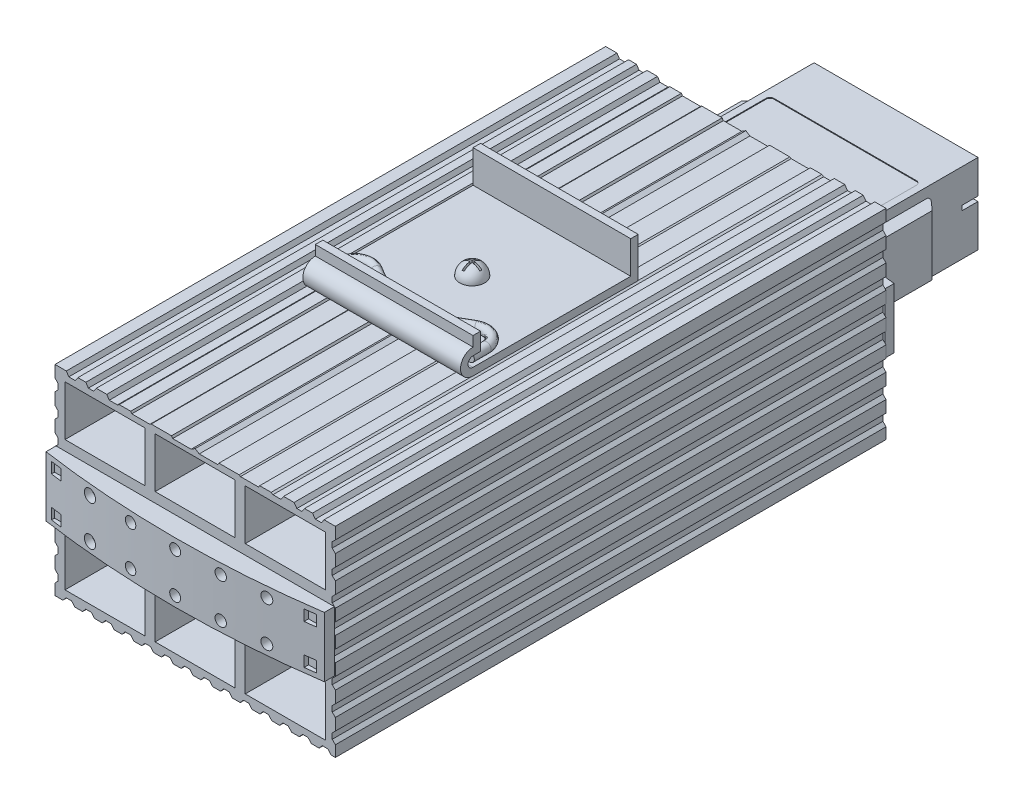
SolidWorks part; units mm, degrees
other "LUMP1"
other "Камера2"
other "Камера3"
ref_plane "Спереди" through (0, 0, 0) normal (0, 0, 1) x (1, 0, 0)
ref_plane "Сверху" through (0, 0, 0) normal (0, 1, 0) x (1, 0, 0)
ref_plane "Справа" through (0, 0, 0) normal (1, 0, 0) x (0, 0, -1)
imported_body "Импортированный1"
sketch "Эскиз1" plane through (0, 0, 139.7) normal (0, 0, 1) x (1, 0, 0)
  line L0 (-35.56, 22.4) -> (-34.76, 21.6)
  line L1 (-35.56, 25.4) -> (-35.56, -25.4) construction
  line L2 (-34.76, 21.6) -> (-34.76, 20.2)
  line L3 (-34.76, 20.2) -> (-35.56, 19.4)
  line L4 (-35.56, 19.4) -> (-36.4722, 19.4)
  line L5 (-36.4722, 19.4) -> (-36.4722, 22.4)
  line L6 (-36.4722, 22.4) -> (-35.56, 22.4)
  line L7 (35.56, 25.4) -> (-35.56, 25.4) construction
  line L8 (0, 25.4) -> (0, 18.4457) construction
  line L9 (-35.56, 16.4) -> (-34.76, 15.6)
  line L10 (-34.76, 15.6) -> (-34.76, 14.2)
  line L11 (-34.76, 14.2) -> (-35.56, 13.4)
  line L12 (-35.56, 13.4) -> (-36.4722, 13.4)
  line L13 (-36.4722, 13.4) -> (-36.4722, 16.4)
  line L14 (-36.4722, 16.4) -> (-35.56, 16.4)
  line L15 (-35.56, 10.4) -> (-34.76, 9.6)
  line L16 (-34.76, 9.6) -> (-34.76, 8.2)
  line L17 (-34.76, 8.2) -> (-35.56, 7.4)
  line L18 (-35.56, 7.4) -> (-36.4722, 7.4)
  line L19 (-36.4722, 7.4) -> (-36.4722, 10.4)
  line L20 (-36.4722, 10.4) -> (-35.56, 10.4)
  line L21 (-35.56, 4.4) -> (-34.76, 3.6)
  line L22 (-34.76, 3.6) -> (-34.76, 2.2)
  line L23 (-34.76, 2.2) -> (-35.56, 1.4)
  line L24 (-35.56, 1.4) -> (-36.4722, 1.4)
  line L25 (-36.4722, 1.4) -> (-36.4722, 4.4)
  line L26 (-36.4722, 4.4) -> (-35.56, 4.4)
  line L27 (-35.56, -1.6) -> (-34.76, -2.4)
  line L28 (-34.76, -2.4) -> (-34.76, -3.8)
  line L29 (-34.76, -3.8) -> (-35.56, -4.6)
  line L30 (-35.56, -4.6) -> (-36.4722, -4.6)
  line L31 (-36.4722, -4.6) -> (-36.4722, -1.6)
  line L32 (-36.4722, -1.6) -> (-35.56, -1.6)
  line L33 (-35.56, -7.6) -> (-34.76, -8.4)
  line L34 (-34.76, -8.4) -> (-34.76, -9.8)
  line L35 (-34.76, -9.8) -> (-35.56, -10.6)
  line L36 (-35.56, -10.6) -> (-36.4722, -10.6)
  line L37 (-36.4722, -10.6) -> (-36.4722, -7.6)
  line L38 (-36.4722, -7.6) -> (-35.56, -7.6)
  line L39 (-35.56, -13.6) -> (-34.76, -14.4)
  line L40 (-34.76, -14.4) -> (-34.76, -15.8)
  line L41 (-34.76, -15.8) -> (-35.56, -16.6)
  line L42 (-35.56, -16.6) -> (-36.4722, -16.6)
  line L43 (-36.4722, -16.6) -> (-36.4722, -13.6)
  line L44 (-36.4722, -13.6) -> (-35.56, -13.6)
  line L45 (-35.56, -19.6) -> (-34.76, -20.4)
  line L46 (-34.76, -20.4) -> (-34.76, -21.8)
  line L47 (-34.76, -21.8) -> (-35.56, -22.6)
  line L48 (-35.56, -22.6) -> (-36.4722, -22.6)
  line L49 (-36.4722, -22.6) -> (-36.4722, -19.6)
  line L50 (-36.4722, -19.6) -> (-35.56, -19.6)
  line L51 (36.4722, -19.6) -> (35.56, -19.6)
  line L52 (36.4722, -22.6) -> (36.4722, -19.6)
  line L53 (35.56, -22.6) -> (36.4722, -22.6)
  line L54 (34.76, -21.8) -> (35.56, -22.6)
  line L55 (34.76, -20.4) -> (34.76, -21.8)
  line L56 (35.56, -19.6) -> (34.76, -20.4)
  line L57 (36.4722, -13.6) -> (35.56, -13.6)
  line L58 (36.4722, -16.6) -> (36.4722, -13.6)
  line L59 (35.56, -16.6) -> (36.4722, -16.6)
  line L60 (34.76, -15.8) -> (35.56, -16.6)
  line L61 (34.76, -14.4) -> (34.76, -15.8)
  line L62 (35.56, -13.6) -> (34.76, -14.4)
  line L63 (36.4722, -7.6) -> (35.56, -7.6)
  line L64 (36.4722, -10.6) -> (36.4722, -7.6)
  line L65 (35.56, -10.6) -> (36.4722, -10.6)
  line L66 (34.76, -9.8) -> (35.56, -10.6)
  line L67 (34.76, -8.4) -> (34.76, -9.8)
  line L68 (35.56, -7.6) -> (34.76, -8.4)
  line L69 (36.4722, -1.6) -> (35.56, -1.6)
  line L70 (36.4722, -4.6) -> (36.4722, -1.6)
  line L71 (35.56, -4.6) -> (36.4722, -4.6)
  line L72 (34.76, -3.8) -> (35.56, -4.6)
  line L73 (34.76, -2.4) -> (34.76, -3.8)
  line L74 (35.56, -1.6) -> (34.76, -2.4)
  line L75 (36.4722, 4.4) -> (35.56, 4.4)
  line L76 (36.4722, 1.4) -> (36.4722, 4.4)
  line L77 (35.56, 1.4) -> (36.4722, 1.4)
  line L78 (34.76, 2.2) -> (35.56, 1.4)
  line L79 (34.76, 3.6) -> (34.76, 2.2)
  line L80 (35.56, 4.4) -> (34.76, 3.6)
  line L81 (36.4722, 10.4) -> (35.56, 10.4)
  line L82 (36.4722, 7.4) -> (36.4722, 10.4)
  line L83 (35.56, 7.4) -> (36.4722, 7.4)
  line L84 (34.76, 8.2) -> (35.56, 7.4)
  line L85 (34.76, 9.6) -> (34.76, 8.2)
  line L86 (35.56, 10.4) -> (34.76, 9.6)
  line L87 (36.4722, 16.4) -> (35.56, 16.4)
  line L88 (36.4722, 13.4) -> (36.4722, 16.4)
  line L89 (35.56, 13.4) -> (36.4722, 13.4)
  line L90 (34.76, 14.2) -> (35.56, 13.4)
  line L91 (34.76, 15.6) -> (34.76, 14.2)
  line L92 (35.56, 16.4) -> (34.76, 15.6)
  line L93 (36.4722, 22.4) -> (35.56, 22.4)
  line L94 (36.4722, 19.4) -> (36.4722, 22.4)
  line L95 (35.56, 19.4) -> (36.4722, 19.4)
  line L96 (34.76, 20.2) -> (35.56, 19.4)
  line L97 (34.76, 21.6) -> (34.76, 20.2)
  line L98 (35.56, 22.4) -> (34.76, 21.6)
  dimension "D1" = 3
  dimension "D2" = 1.4
  dimension "D3" = 0.8
  dimension "D4" = 3
  dimension "D5" = 8
extrude "Вырез-Вытянуть1" cut sketch "Эскиз1" against normal up to surface (139.7 mm away)
sketch "Эскиз2" plane through (0, 0, 139.7) normal (0, 0, 1) x (1, 0, 0)
  line L0 (-33.56, -25.4) -> (-32.76, -24.458)
  line L1 (-35.56, -25.4) -> (35.56, -25.4) construction
  line L2 (-32.76, -24.458) -> (-31.36, -24.458)
  line L3 (-31.36, -24.458) -> (-30.56, -25.4)
  line L4 (-30.56, -25.4) -> (-30.56, -26.268)
  line L5 (-30.56, -26.268) -> (-33.56, -26.268)
  line L6 (-33.56, -26.268) -> (-33.56, -25.4)
  line L7 (-35.56, -22.6) -> (-35.56, -25.4) construction
  line L8 (-28.56, -25.4) -> (-27.76, -24.458)
  line L9 (-27.76, -24.458) -> (-26.36, -24.458)
  line L10 (-26.36, -24.458) -> (-25.56, -25.4)
  line L11 (-25.56, -25.4) -> (-25.56, -26.268)
  line L12 (-25.56, -26.268) -> (-28.56, -26.268)
  line L13 (-28.56, -26.268) -> (-28.56, -25.4)
  line L14 (-23.56, -25.4) -> (-22.76, -24.458)
  line L15 (-22.76, -24.458) -> (-21.36, -24.458)
  line L16 (-21.36, -24.458) -> (-20.56, -25.4)
  line L17 (-20.56, -25.4) -> (-20.56, -26.268)
  line L18 (-20.56, -26.268) -> (-23.56, -26.268)
  line L19 (-23.56, -26.268) -> (-23.56, -25.4)
  line L20 (-18.56, -25.4) -> (-17.76, -24.458)
  line L21 (-17.76, -24.458) -> (-16.36, -24.458)
  line L22 (-16.36, -24.458) -> (-15.56, -25.4)
  line L23 (-15.56, -25.4) -> (-15.56, -26.268)
  line L24 (-15.56, -26.268) -> (-18.56, -26.268)
  line L25 (-18.56, -26.268) -> (-18.56, -25.4)
  line L26 (-13.56, -25.4) -> (-12.76, -24.458)
  line L27 (-12.76, -24.458) -> (-11.36, -24.458)
  line L28 (-11.36, -24.458) -> (-10.56, -25.4)
  line L29 (-10.56, -25.4) -> (-10.56, -26.268)
  line L30 (-10.56, -26.268) -> (-13.56, -26.268)
  line L31 (-13.56, -26.268) -> (-13.56, -25.4)
  line L32 (-8.56, -25.4) -> (-7.76, -24.458)
  line L33 (-7.76, -24.458) -> (-6.36, -24.458)
  line L34 (-6.36, -24.458) -> (-5.56, -25.4)
  line L35 (-5.56, -25.4) -> (-5.56, -26.268)
  line L36 (-5.56, -26.268) -> (-8.56, -26.268)
  line L37 (-8.56, -26.268) -> (-8.56, -25.4)
  line L38 (-3.56, -25.4) -> (-2.76, -24.458)
  line L39 (-2.76, -24.458) -> (-1.36, -24.458)
  line L40 (-1.36, -24.458) -> (-0.56, -25.4)
  line L41 (-0.56, -25.4) -> (-0.56, -26.268)
  line L42 (-0.56, -26.268) -> (-3.56, -26.268)
  line L43 (-3.56, -26.268) -> (-3.56, -25.4)
  line L44 (1.44, -25.4) -> (2.24, -24.458)
  line L45 (2.24, -24.458) -> (3.64, -24.458)
  line L46 (3.64, -24.458) -> (4.44, -25.4)
  line L47 (4.44, -25.4) -> (4.44, -26.268)
  line L48 (4.44, -26.268) -> (1.44, -26.268)
  line L49 (1.44, -26.268) -> (1.44, -25.4)
  line L50 (6.44, -25.4) -> (7.24, -24.458)
  line L51 (7.24, -24.458) -> (8.64, -24.458)
  line L52 (8.64, -24.458) -> (9.44, -25.4)
  line L53 (9.44, -25.4) -> (9.44, -26.268)
  line L54 (9.44, -26.268) -> (6.44, -26.268)
  line L55 (6.44, -26.268) -> (6.44, -25.4)
  line L56 (11.44, -25.4) -> (12.24, -24.458)
  line L57 (12.24, -24.458) -> (13.64, -24.458)
  line L58 (13.64, -24.458) -> (14.44, -25.4)
  line L59 (14.44, -25.4) -> (14.44, -26.268)
  line L60 (14.44, -26.268) -> (11.44, -26.268)
  line L61 (11.44, -26.268) -> (11.44, -25.4)
  line L62 (16.44, -25.4) -> (17.24, -24.458)
  line L63 (17.24, -24.458) -> (18.64, -24.458)
  line L64 (18.64, -24.458) -> (19.44, -25.4)
  line L65 (19.44, -25.4) -> (19.44, -26.268)
  line L66 (19.44, -26.268) -> (16.44, -26.268)
  line L67 (16.44, -26.268) -> (16.44, -25.4)
  line L68 (21.44, -25.4) -> (22.24, -24.458)
  line L69 (22.24, -24.458) -> (23.64, -24.458)
  line L70 (23.64, -24.458) -> (24.44, -25.4)
  line L71 (24.44, -25.4) -> (24.44, -26.268)
  line L72 (24.44, -26.268) -> (21.44, -26.268)
  line L73 (21.44, -26.268) -> (21.44, -25.4)
  line L74 (26.44, -25.4) -> (27.24, -24.458)
  line L75 (27.24, -24.458) -> (28.64, -24.458)
  line L76 (28.64, -24.458) -> (29.44, -25.4)
  line L77 (29.44, -25.4) -> (29.44, -26.268)
  line L78 (29.44, -26.268) -> (26.44, -26.268)
  line L79 (26.44, -26.268) -> (26.44, -25.4)
  line L80 (31.44, -25.4) -> (32.24, -24.458)
  line L81 (32.24, -24.458) -> (33.64, -24.458)
  line L82 (33.64, -24.458) -> (34.44, -25.4)
  line L83 (34.44, -25.4) -> (34.44, -26.268)
  line L84 (34.44, -26.268) -> (31.44, -26.268)
  line L85 (31.44, -26.268) -> (31.44, -25.4)
  dimension "D1" = 3
  dimension "D2" = 1.4
  dimension "D3" = 0.8
  dimension "D4" = 2
  dimension "D5" = 14
extrude "Вырез-Вытянуть2" cut sketch "Эскиз2" against normal up to surface (139.7 mm away)
sketch "Эскиз3" plane through (0, 0, 139.7) normal (0, 0, 1) x (1, 0, 0)
  line L0 (0, 26.3484) -> (0, 18.8696) construction
  line L1 (-32.6919, 25.4) -> (-32.0578, 24.4207)
  line L2 (35.56, 25.4) -> (-35.56, 25.4) construction
  line L3 (-32.0578, 24.4207) -> (-30.4726, 24.4207)
  line L4 (-30.4726, 24.4207) -> (-29.7592, 25.4)
  line L5 (-29.7592, 25.4) -> (-27.738, 25.4)
  line L6 (-27.738, 25.4) -> (-27.1038, 24.4207)
  line L7 (-27.1038, 24.4207) -> (-25.796, 24.4207)
  line L8 (-25.796, 24.4207) -> (-25.0826, 25.4)
  line L9 (-25.0826, 25.4) -> (-22.4273, 25.4)
  line L10 (-22.4273, 25.4) -> (-21.7932, 24.4207)
  line L11 (-21.7932, 24.4207) -> (-19.7323, 24.4207)
  line L12 (-19.7323, 24.4207) -> (-19.2723, 24.7186)
  line L13 (-19.2723, 24.7186) -> (-16.3636, 24.7186)
  line L14 (-16.3636, 24.7186) -> (-16.0808, 24.2819)
  line L15 (-16.0808, 24.2819) -> (-11.4889, 24.2819)
  line L16 (-11.4889, 24.2819) -> (-11.1517, 24.5003)
  line L17 (-11.1517, 24.5003) -> (-6.0197, 24.5003)
  line L18 (-6.0197, 24.5003) -> (-5.7163, 24.0318)
  line L19 (-5.7163, 24.0318) -> (-1.0261, 24.0318)
  line L20 (-1.0261, 24.0318) -> (-0.6643, 24.266)
  line L21 (-0.6643, 24.266) -> (0, 24.6962)
  line L22 (-32.6919, 25.4) -> (-32.6919, 26.3484)
  line L23 (-32.6919, 26.3484) -> (-20.0025, 26.3484)
  line L24 (-20.0025, 31.75) -> (-20.0025, 25.4) construction
  line L25 (-20.0025, 26.3484) -> (-20.0025, 25.4)
  line L26 (20.0025, 26.3484) -> (20.0025, 25.4)
  line L27 (32.6919, 26.3484) -> (20.0025, 26.3484)
  line L28 (32.6919, 25.4) -> (32.6919, 26.3484)
  line L29 (0.6643, 24.266) -> (0, 24.6962)
  line L30 (1.0261, 24.0318) -> (0.6643, 24.266)
  line L31 (5.7163, 24.0318) -> (1.0261, 24.0318)
  line L32 (6.0197, 24.5003) -> (5.7163, 24.0318)
  line L33 (11.1517, 24.5003) -> (6.0197, 24.5003)
  line L34 (11.4889, 24.2819) -> (11.1517, 24.5003)
  line L35 (16.0808, 24.2819) -> (11.4889, 24.2819)
  line L36 (16.3636, 24.7186) -> (16.0808, 24.2819)
  line L37 (19.2723, 24.7186) -> (16.3636, 24.7186)
  line L38 (19.7323, 24.4207) -> (19.2723, 24.7186)
  line L39 (21.7932, 24.4207) -> (19.7323, 24.4207)
  line L40 (22.4273, 25.4) -> (21.7932, 24.4207)
  line L41 (25.0826, 25.4) -> (22.4273, 25.4)
  line L42 (25.796, 24.4207) -> (25.0826, 25.4)
  line L43 (27.1038, 24.4207) -> (25.796, 24.4207)
  line L44 (27.738, 25.4) -> (27.1038, 24.4207)
  line L45 (29.7592, 25.4) -> (27.738, 25.4)
  line L46 (30.4726, 24.4207) -> (29.7592, 25.4)
  line L47 (32.0578, 24.4207) -> (30.4726, 24.4207)
  line L48 (32.6919, 25.4) -> (32.0578, 24.4207)
  line L49 (-20.0025, 25.4) -> (20.0025, 25.4)
extrude "Вырез-Вытянуть3" cut sketch "Эскиз3" against normal up to surface (139.7 mm away)
ref_plane "Плоскость1" through (0, 0, 145.7) normal (0, 0, 1) x (1, 0, 0)
sketch "Эскиз4" plane through (0, 0, 145.7) normal (0, 0, 1) x (1, 0, 0)
  line L0 (0, 0) -> (5.2597, 0) construction
  line L1 (-33.6904, 6.4372) -> (-30.9184, 6.4372)
  line L2 (-33.6904, 6.4372) -> (-33.6904, 3.6652)
  line L3 (-33.6904, 3.6652) -> (-30.9184, 3.6652)
  line L4 (-30.9184, 6.4372) -> (-30.9184, 3.6652)
  line L5 (33.5482, 6.4372) -> (30.7762, 6.4372)
  line L6 (33.5482, 6.4372) -> (33.5482, 3.6652)
  line L7 (33.5482, 3.6652) -> (30.7762, 3.6652)
  line L8 (30.7762, 6.4372) -> (30.7762, 3.6652)
  line L9 (30.7762, -6.4372) -> (30.7762, -3.6652)
  line L10 (33.5482, -3.6652) -> (30.7762, -3.6652)
  line L11 (33.5482, -6.4372) -> (33.5482, -3.6652)
  line L12 (33.5482, -6.4372) -> (30.7762, -6.4372)
  line L13 (-30.9184, -6.4372) -> (-30.9184, -3.6652)
  line L14 (-33.6904, -3.6652) -> (-30.9184, -3.6652)
  line L15 (-33.6904, -6.4372) -> (-33.6904, -3.6652)
  line L16 (-33.6904, -6.4372) -> (-30.9184, -6.4372)
  circle A0 centre (-22.6735, 5.0512) radius 1.5576
  circle A1 centre (-11.5855, 5.0512) radius 1.386
  circle A2 centre (0, 5.0512) radius 1.386
  circle A3 centre (11.3012, 5.0512) radius 1.386
  circle A4 centre (22.247, 5.0512) radius 1.386
  circle A5 centre (22.247, -5.0512) radius 1.386
  circle A6 centre (11.3012, -5.0512) radius 1.386
  circle A7 centre (0, -5.0512) radius 1.386
  circle A8 centre (-11.5855, -5.0512) radius 1.386
  circle A9 centre (-22.6735, -5.0512) radius 1.5576
extrude "Вырез-Вытянуть4" cut sketch "Эскиз4" against normal blind 4
sketch "Эскиз5" plane through (0, -11.684, 0) normal (0, -1, 0) x (1, 0, 0)
  circle A0 centre (-12.5908, -33.02) radius 2.0132
extrude "Вырез-Вытянуть5" cut sketch "Эскиз5" against normal blind 0.5
sketch "Эскиз6" plane through (0, -11.184, 0) normal (0, -1, 0) x (1, 0, 0)
  line L0 (-12.5908, -31.0068) -> (-12.5908, -35.0332) construction
  line L2 (-13.5908, -33.789) -> (-11.5908, -33.789)
  line L3 (-13.5908, -33.789) -> (-13.5908, -34.029)
  line L4 (-13.5908, -34.029) -> (-11.5908, -34.029)
  line L5 (-11.5908, -33.789) -> (-11.5908, -34.029)
  line L6 (-13.8908, -33.249) -> (-11.2908, -33.249)
  line L7 (-13.8908, -33.249) -> (-13.8908, -33.489)
  line L8 (-13.8908, -33.489) -> (-11.2908, -33.489)
  line L9 (-11.2908, -33.249) -> (-11.2908, -33.489)
  line L10 (-14.0382, -32.709) -> (-12.7108, -32.709)
  line L11 (-14.0382, -32.709) -> (-14.0382, -32.949)
  line L12 (-14.0382, -32.949) -> (-11.1248, -32.949)
  line L13 (-11.1248, -32.709) -> (-11.1248, -32.949)
  line L14 (-12.7108, -31.2596) -> (-12.4708, -31.2596)
  line L15 (-12.7108, -31.2596) -> (-12.7108, -32.709)
  line L17 (-12.4708, -31.2596) -> (-12.4708, -32.709)
  line L18 (-12.4708, -32.709) -> (-11.1248, -32.709)
  circle A0 centre (-12.5908, -33.02) radius 2.0132 construction
  circle A1 centre (-12.5908, -33.02) radius 2.0132 construction
  dimension "D1" = 0.24
  dimension "D2" = 1
  dimension "D3" = 2
  dimension "D4" = 0.24
  dimension "D5" = 1.3
  dimension "D6" = 2.6
  dimension "D7" = 0.24
  dimension "D8" = 0.12
  dimension "D9" = 0.24
  dimension "D10" = 0.3
  dimension "D11" = 0.3
extrude "Бобышка-Вытянуть1" add sketch "Эскиз6" along normal blind 0.6
sketch "Эскиз7" plane through (0, -11.684, 0) normal (0, -1, 0) x (1, 0, 0)
  circle A0 centre (-0.0025, -33.02) radius 2.0398
extrude "Вырез-Вытянуть6" cut sketch "Эскиз7" against normal blind 0.5
sketch "Эскиз8" plane through (0, -11.184, 0) normal (0, -1, 0) x (1, 0, 0)
  line L0 (-0.542, -31.3303) -> (-0.542, -34.008)
  line L1 (-0.542, -34.008) -> (1.2756, -34.008)
  line L2 (1.2756, -34.008) -> (1.2756, -34.248)
  line L3 (1.2756, -34.248) -> (-0.782, -34.248)
  line L4 (-0.782, -34.248) -> (-0.782, -31.3303)
  line L5 (-0.782, -31.3303) -> (-0.542, -31.3303)
  dimension "D1" = 0.24
  dimension "D2" = 0.24
extrude "Бобышка-Вытянуть2" add sketch "Эскиз8" along normal blind 0.6
sketch "Эскиз9" plane through (0, -11.684, 0) normal (0, -1, 0) x (1, 0, 0)
  circle A0 centre (12.5857, -33.02) radius 2.0229
extrude "Вырез-Вытянуть7" cut sketch "Эскиз9" against normal blind 0.6
sketch "Эскиз10" plane through (0, -11.084, 0) normal (0, -1, 0) x (1, 0, 0)
  line L0 (13.7431, -31.5917) -> (13.7431, -34.3518)
  line L1 (13.7431, -34.3518) -> (13.479, -34.3518)
  line L2 (13.479, -34.3518) -> (11.6964, -31.9271)
  line L3 (11.6964, -31.9271) -> (11.6964, -34.3518)
  line L4 (11.6964, -34.3518) -> (11.4564, -34.3518)
  line L5 (11.4564, -34.3518) -> (11.4564, -31.5547)
  line L6 (11.4564, -31.5547) -> (11.7206, -31.5547)
  line L7 (11.7206, -31.5547) -> (13.5031, -33.9794)
  line L8 (13.5031, -33.9794) -> (13.5031, -31.5917)
  line L9 (13.5031, -31.5917) -> (13.7431, -31.5917)
  dimension "D1" = 0.24
  dimension "D2" = 0.24
  dimension "D3" = 0.24
extrude "Бобышка-Вытянуть3" add sketch "Эскиз10" along normal blind 0.6
sketch "Эскиз11" plane through (0, 0, -38.1) normal (0, 0, -1) x (-1, 0, 0)
  line L0 (20.7892, -7.62) -> (20.7892, 7.62) construction
  line L1 (20.7892, 0.4731) -> (-20.7892, 0.4731)
  line L2 (20.7892, 0.4731) -> (20.7892, 1.6661)
  line L3 (20.7892, 1.6661) -> (-20.7892, 1.6661)
  line L4 (-20.7892, 0.4731) -> (-20.7892, 1.6661)
  line L5 (-20.7892, -10.16) -> (-20.7892, 10.16) construction
extrude "Вырез-Вытянуть8" cut sketch "Эскиз11" against normal blind 4
sketch "Эскиз12" plane through (0, -10.16, 0) normal (0, -1, 0) x (1, 0, 0)
  line L0 (-18.2499, -30.48) -> (-18.2499, -35.56) construction
  line L1 (-19.1499, -8.1129) -> (-18.5499, -8.1129)
  line L2 (-19.1499, -8.1129) -> (-19.1499, -36.2162)
  line L4 (-18.5499, -8.1129) -> (-18.5499, -35.7896)
  line L5 (-6.5617, -8.1129) -> (-5.9617, -8.1129)
  line L6 (-6.5617, -8.1129) -> (-6.5617, -35.7896)
  line L8 (-5.9617, -8.1129) -> (-5.9617, -35.7896)
  line L9 (6.6266, -8.1129) -> (6.0266, -8.1129)
  line L10 (6.6266, -8.1129) -> (6.6266, -35.7855)
  line L12 (6.0266, -8.1129) -> (6.0266, -35.7896)
  line L15 (18.5448, -8.1129) -> (19.1448, -8.1129)
  line L16 (19.1448, -36.2162) -> (19.1448, -8.1129)
  line L17 (-5.6617, -30.48) -> (-5.6617, -35.56) construction
  line L18 (6.9266, -35.56) -> (6.9266, -30.48) construction
  line L21 (-19.1499, -36.2162) -> (19.1448, -36.2162)
  line L26 (-5.9617, -35.7896) -> (6.0266, -35.7896)
  line L29 (-18.5499, -35.7896) -> (-6.5617, -35.7896)
  line L30 (6.6266, -35.7855) -> (18.5448, -35.7855)
  line L34 (18.5448, -35.7855) -> (18.5448, -8.1129)
  dimension "D1" = 0.6
  dimension "D2" = 0.3
  dimension "D3" = 0.6
  dimension "D4" = 0.3
  dimension "D5" = 0.6
  dimension "D6" = 0.3
extrude "Вырез-Вытянуть9" cut sketch "Эскиз12" against normal blind 1
ref_plane "Плоскость2" through (0, 0, -6) normal (0, 0, -1) x (-1, 0, 0)
sketch "Эскиз13" plane through (0, 0, -6) normal (0, 0, -1) x (-1, 0, 0)
  line L1 (-33.9569, 6.3727) -> (-31.232, 6.3727)
  line L2 (-33.9569, 6.3727) -> (-33.9569, 3.508)
  line L3 (-33.9569, 3.508) -> (-31.232, 3.508)
  line L4 (-31.232, 6.3727) -> (-31.232, 3.508)
  line L5 (30.7429, 6.3727) -> (33.5377, 6.3727)
  line L6 (30.7429, 6.3727) -> (30.7429, 3.508)
  line L7 (30.7429, 3.508) -> (33.5377, 3.508)
  line L8 (33.5377, 6.3727) -> (33.5377, 3.508)
  line L9 (33.5377, -6.0642) -> (30.7429, -6.0642)
  line L10 (33.5377, -6.0642) -> (33.5377, -2.8502)
  line L11 (33.5377, -2.8502) -> (30.7429, -2.8502)
  line L12 (30.7429, -6.0642) -> (30.7429, -2.8502)
  line L13 (-31.232, -6.0642) -> (-33.9569, -6.0642)
  line L14 (-31.232, -6.0642) -> (-31.232, -2.8502)
  line L15 (-31.232, -2.8502) -> (-33.9569, -2.8502)
  line L16 (-33.9569, -6.0642) -> (-33.9569, -2.8502)
extrude "Вырез-Вытянуть10" cut sketch "Эскиз13" against normal blind 4
ref_plane "Плоскость3" through (0, 28.555, 0) normal (0, 1, 0) x (1, 0, 0)
sketch "Эскиз14" plane through (0, 28.555, 0) normal (0, 1, 0) x (1, 0, 0)
  line L0 (-18.4875, -90.3108) -> (-18.4875, -84.0764)
  line L1 (-12.1845, -81.5701) -> (-1.1719, -87.9283)
  line L2 (-20.0025, -87.3125) -> (20.0025, -87.3125) construction
  arc A0 (-18.4875, -84.0764) -> (-12.1845, -81.5701) centre (-14.6245, -84.6125) cw
  dimension "D2" = 3.9
  dimension "D1" = 2.7
  dimension "D3" = 60
ref_plane "Плоскость4" through (0, 0, 88.5625) normal (0, 0, -1) x (-1, 0, 0)
sketch "Эскиз15" plane through (0, 0, 88.5625) normal (0, 0, -1) x (-1, 0, 0)
  line L0 (18.4875, 28.555) -> (12.1845, 28.555) construction
  circle A0 centre (18.4875, 28.555) radius 1.1514
sweep "По траектории1" add profiles "Эскиз15" path "Эскиз14"
sketch "Эскиз16" plane through (0, 28.555, 0) normal (0, 1, 0) x (1, 0, 0)
  line L0 (18.6094, -89.5898) -> (18.6094, -84.3099)
  line L1 (12.7646, -81.135) -> (1.3619, -87.7184)
  line L2 (-20.0025, -87.3125) -> (20.0025, -87.3125) construction
  arc A0 (18.6094, -84.3099) -> (12.7646, -81.135) centre (14.7146, -84.5125) ccw
  dimension "D2" = 3.9
  dimension "D1" = 2.8
  dimension "D3" = 60
sketch "Эскиз17" plane through (0, 0, 88.5625) normal (0, 0, -1) x (-1, 0, 0)
  line L0 (-12.7646, 28.555) -> (-18.6094, 28.555) construction
  circle A0 centre (-18.4828, 28.555) radius 1.1931
sweep "По траектории2" add profiles "Эскиз17" path "Эскиз16"
sketch "Эскиз18" plane through (0, 27.305, 0) normal (0, 1, 0) x (1, 0, 0)
  line L0 (-20.0025, -69.215) -> (20.0025, -69.215) construction
  line L1 (-20.0025, -89.2175) -> (-20.0025, -49.2125) construction
  line L2 (20.0025, -89.2175) -> (20.0025, -49.2125) construction
  line L3 (-3.3605, -69.215) -> (2.9512, -69.215)
  arc A0 (-3.3605, -69.215) -> (2.9512, -69.215) centre (-0.2047, -69.215) cw
revolve "Повернуть1" add sketch "Эскиз18" angle 180 about L0
ref_plane "Плоскость5" through (0, 32.305, 0) normal (0, 1, 0) x (1, 0, 0)
sketch "Эскиз19" plane through (0, 32.305, 0) normal (0, 1, 0) x (1, 0, 0)
  line L0 (-0.25, -66.0595) -> (-0.25, -72.3705) construction
  line L1 (-3.3605, -69.215) -> (2.9512, -69.215) construction
  line L2 (-0.5, -66.965) -> (0, -66.965)
  line L3 (0, -66.965) -> (0, -68.965)
  line L4 (0, -68.965) -> (2, -68.965)
  line L5 (2, -68.965) -> (2, -69.465)
  line L6 (2, -69.465) -> (0, -69.465)
  line L7 (0, -69.465) -> (0, -71.465)
  line L8 (0, -71.465) -> (-0.5, -71.465)
  line L9 (-0.5, -71.465) -> (-0.5, -69.465)
  line L10 (-0.5, -69.465) -> (-2.5, -69.465)
  line L11 (-2.5, -69.465) -> (-2.5, -68.965)
  line L12 (-2.5, -68.965) -> (-0.5, -68.965)
  line L13 (-0.5, -68.965) -> (-0.5, -66.965)
  circle A0 centre (-0.2047, -69.215) radius 3.1558 construction
  dimension "D1" = 0.25
  dimension "D2" = 0.25
  dimension "D3" = 0.25
  dimension "D4" = 0.25
  dimension "D5" = 0.25
  dimension "D6" = 0.25
  dimension "D7" = 0.25
  dimension "D8" = 2
  dimension "D9" = 2
  dimension "D10" = 2
  dimension "D11" = 2
extrude "Вырез-Вытянуть11" cut sketch "Эскиз19" against normal blind 4
sketch "Эскиз20" plane through (0, 10.16, 0) normal (0, 1, 0) x (1, 0, 0)
  line L1 (18.0906, 7.5595) -> (-18.0766, 7.5595)
  line L2 (19.0906, 8.5595) -> (19.0906, 24.1872)
  line L3 (18.0906, 25.1872) -> (-18.0766, 25.1872)
  line L4 (-19.0766, 8.5595) -> (-19.0766, 24.1872)
  line L5 (19.0906, 7.5595) -> (-19.0766, 25.1872) construction
  line L6 (19.0906, 25.1872) -> (-19.0766, 7.5595) construction
  arc A0 (19.0906, 24.1872) -> (18.0906, 25.1872) centre (18.0906, 24.1872) ccw
  arc A1 (-18.0766, 7.5595) -> (-19.0766, 8.5595) centre (-18.0766, 8.5595) cw
  arc A2 (-18.0766, 25.1872) -> (-19.0766, 24.1872) centre (-18.0766, 24.1872) ccw
  arc A3 (18.0906, 7.5595) -> (19.0906, 8.5595) centre (18.0906, 8.5595) ccw
  point P4 (0.007, 16.3733)
  dimension "D1" = 1
sketch "Эскиз21" plane through (0, 10.16, 0) normal (0, 1, 0) x (1, 0, 0)
  line L0 (18.0906, 7.5595) -> (-18.0766, 7.5595)
  line L1 (19.0906, 8.5595) -> (19.0906, 24.1872)
  line L2 (18.0906, 25.1872) -> (-18.0766, 25.1872)
  line L3 (-19.0766, 8.5595) -> (-19.0766, 24.1872)
  line L4 (19.0906, 7.5595) -> (-19.0766, 25.1872) construction
  line L5 (19.0906, 25.1872) -> (-19.0766, 7.5595) construction
  arc A0 (19.0906, 24.1872) -> (18.0906, 25.1872) centre (18.0906, 24.1872) ccw
  arc A1 (-18.0766, 7.5595) -> (-19.0766, 8.5595) centre (-18.0766, 8.5595) cw
  arc A2 (-18.0766, 25.1872) -> (-19.0766, 24.1872) centre (-18.0766, 24.1872) ccw
  arc A3 (18.0906, 7.5595) -> (19.0906, 8.5595) centre (18.0906, 8.5595) ccw
  point P4 (0.007, 16.3733)
  dimension "D1" = 1
extrude "Вырез-Вытянуть12" cut sketch "Эскиз21" against normal blind 0.2
